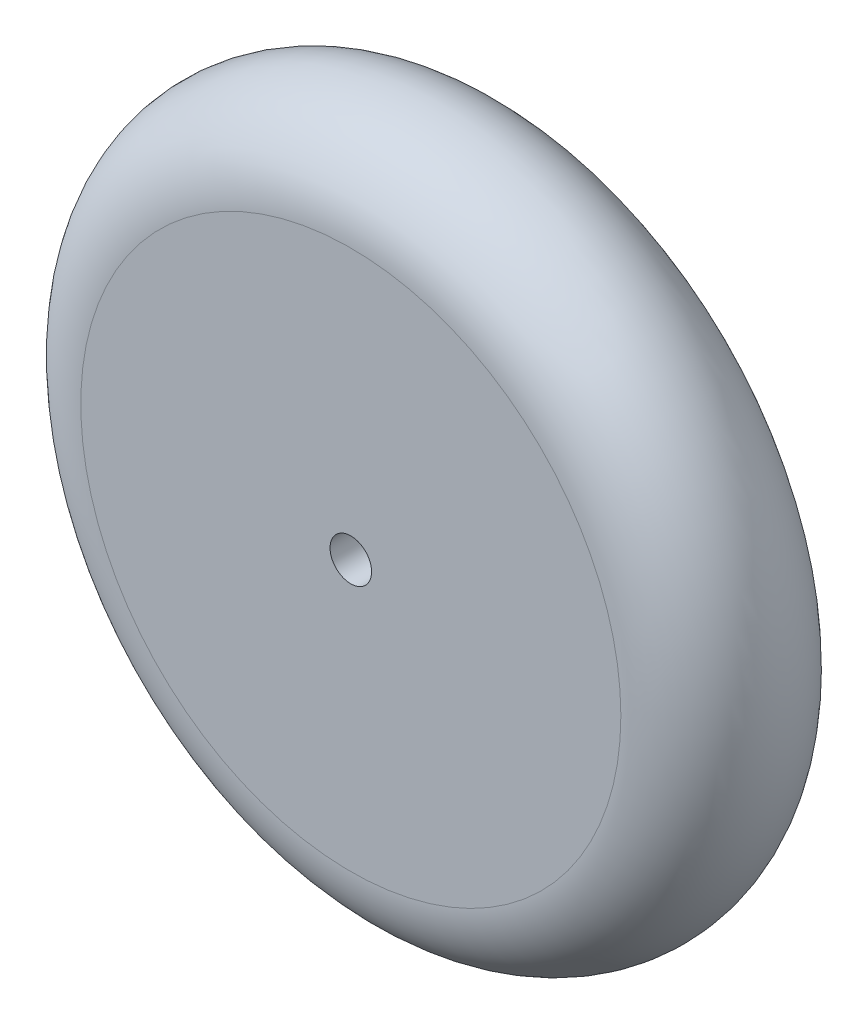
SolidWorks part; units mm, degrees
ref_plane "Plan de face" through (0, 0, 0) normal (0, 0, 1) x (1, 0, 0)
ref_plane "Plan de dessus" through (0, 0, 0) normal (0, 1, 0) x (1, 0, 0)
ref_plane "Plan de droite" through (0, 0, 0) normal (1, 0, 0) x (0, 0, -1)
sketch "Esquisse1" plane through (0, 0, 0) normal (0, 1, 0) x (1, 0, 0)
  line L0 (0, -19.9096) -> (0, 38.5405) construction
  line L1 (0, 0) -> (75.3429, 0) construction
  line L2 (5, -20) -> (5, 20)
  line L3 (5, 20) -> (65, 20)
  line L8 (5, -20) -> (65, -20)
  arc A0 (65, 20) -> (65, -20) centre (65, 0) cw
  point P14 (5, 0)
  dimension "D1" = 5
  dimension "D2" = 60
  dimension "D5" = 40
revolve "Révolution1" add sketch "Esquisse1" angle 360 about L0
